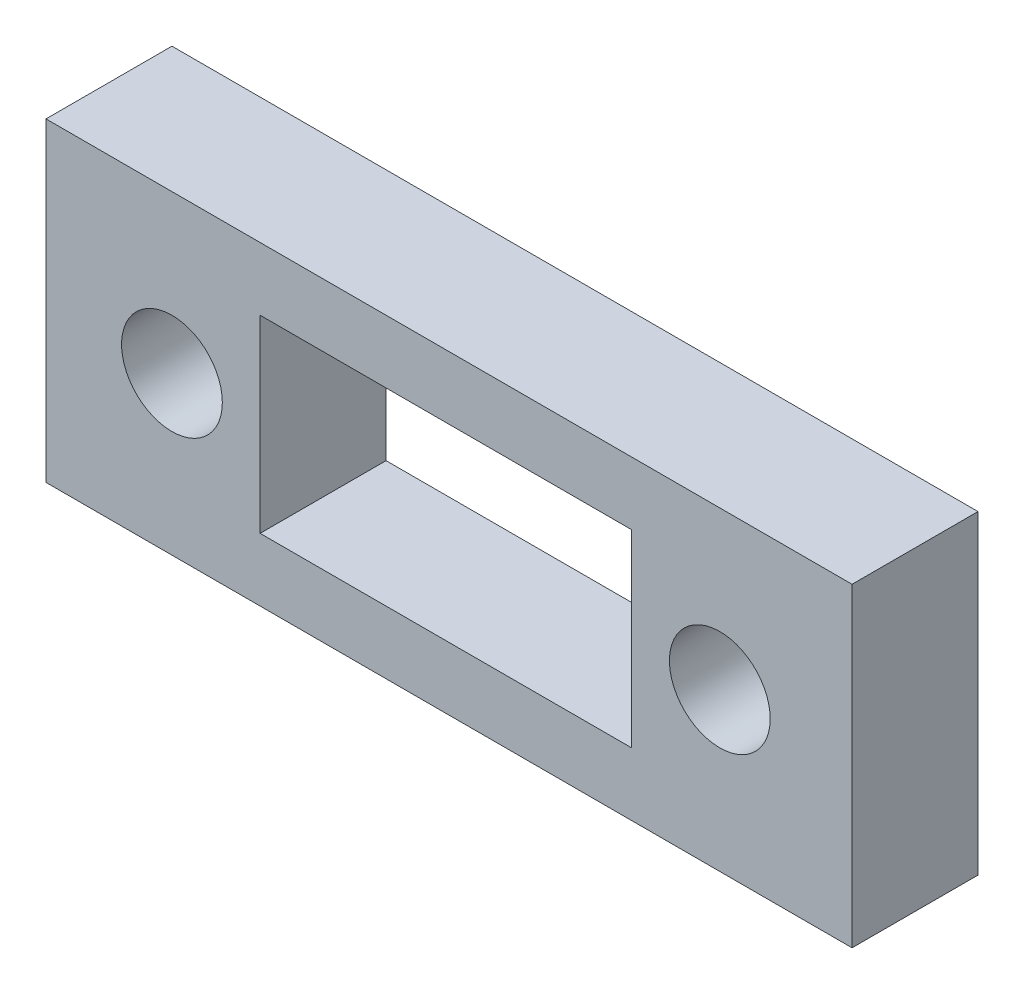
SolidWorks part; units mm, degrees
ref_plane "Plan de face" through (0, 0, 0) normal (0, 0, 1) x (1, 0, 0)
ref_plane "Plan de dessus" through (0, 0, 0) normal (0, 1, 0) x (1, 0, 0)
ref_plane "Plan de droite" through (0, 0, 0) normal (1, 0, 0) x (0, 0, -1)
sketch "Esquisse1" plane through (0, 0, 0) normal (0, 0, 1) x (1, 0, 0)
  line L1 (-7.0495, 9.4742) -> (56.9505, 9.4742)
  line L2 (-7.0495, 9.4742) -> (-7.0495, -15.5258)
  line L3 (-7.0495, -15.5258) -> (56.9505, -15.5258)
  line L4 (56.9505, 9.4742) -> (56.9505, -15.5258)
  dimension "D1" = 25
  dimension "D2" = 64
extrude "Boss.-Extru.1" add sketch "Esquisse1" along normal blind 10
sketch "Esquisse2" plane through (0, 0, 10) normal (0, 0, 1) x (1, 0, 0)
  line L1 (-7.0495, 9.4742) -> (-7.0495, -15.5258) construction
  line L2 (56.9505, -15.5258) -> (56.9505, 9.4742) construction
  line L3 (-7.0495, -15.5258) -> (56.9505, -15.5258) construction
  line L4 (56.9505, 9.4742) -> (-7.0495, 9.4742) construction
  circle A0 centre (2.9505, -3.0258) radius 4
  circle A1 centre (46.4505, -3.0258) radius 4
  dimension "D1" = 8
  dimension "D2" = 8
  dimension "D4" = 10
  dimension "D5" = 10.5
  dimension "D3" = 43.5
  dimension "D6" = 12.5
  dimension "D7" = 12.5
  dimension "D8" = 12.5
extrude "Enlèv. mat.-Extru.3" cut sketch "Esquisse2" against normal blind 10
sketch "Esquisse4" plane through (0, 0, 10) normal (0, 0, 1) x (1, 0, 0)
  line L0 (-7.0495, -15.5258) -> (56.9505, -15.5258) construction
  line L1 (9.9505, -10.5258) -> (39.4505, -10.5258)
  line L2 (9.9505, -10.5258) -> (9.9505, 4.4742)
  line L3 (9.9505, 4.4742) -> (39.4505, 4.4742)
  line L4 (39.4505, -10.5258) -> (39.4505, 4.4742)
  line L5 (56.9505, 9.4742) -> (-7.0495, 9.4742) construction
  circle A0 centre (2.9505, -3.0258) radius 4 construction
  circle A1 centre (46.4505, -3.0258) radius 4 construction
  dimension "D1" = 7
  dimension "D2" = 7
  dimension "D3" = 5
  dimension "D4" = 5
extrude "Enlèv. mat.-Extru.4" cut sketch "Esquisse4" against normal blind 10
